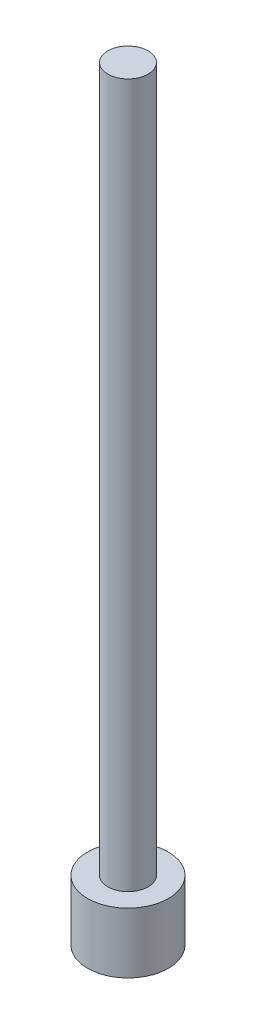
SolidWorks part; units mm, degrees
ref_plane "Plan de face" through (0, 0, 0) normal (0, 0, 1) x (1, 0, 0)
ref_plane "Plan de dessus" through (0, 0, 0) normal (0, 1, 0) x (1, 0, 0)
ref_plane "Plan de droite" through (0, 0, 0) normal (1, 0, 0) x (0, 0, -1)
sketch "Esquisse1" plane through (0, 0, 0) normal (0, 1, 0) x (1, 0, 0)
  circle A0 centre (0, 0) radius 2
  dimension "D1" = 4
extrude "Extrusion1" add sketch "Esquisse1" along normal blind 3
sketch "Esquisse2" plane through (0, 3, 0) normal (0, 1, 0) x (-1, 0, 0)
  circle A0 centre (0, 0) radius 1
  dimension "D1" = 2
extrude "Extrusion2" add sketch "Esquisse2" along normal blind 34.9
